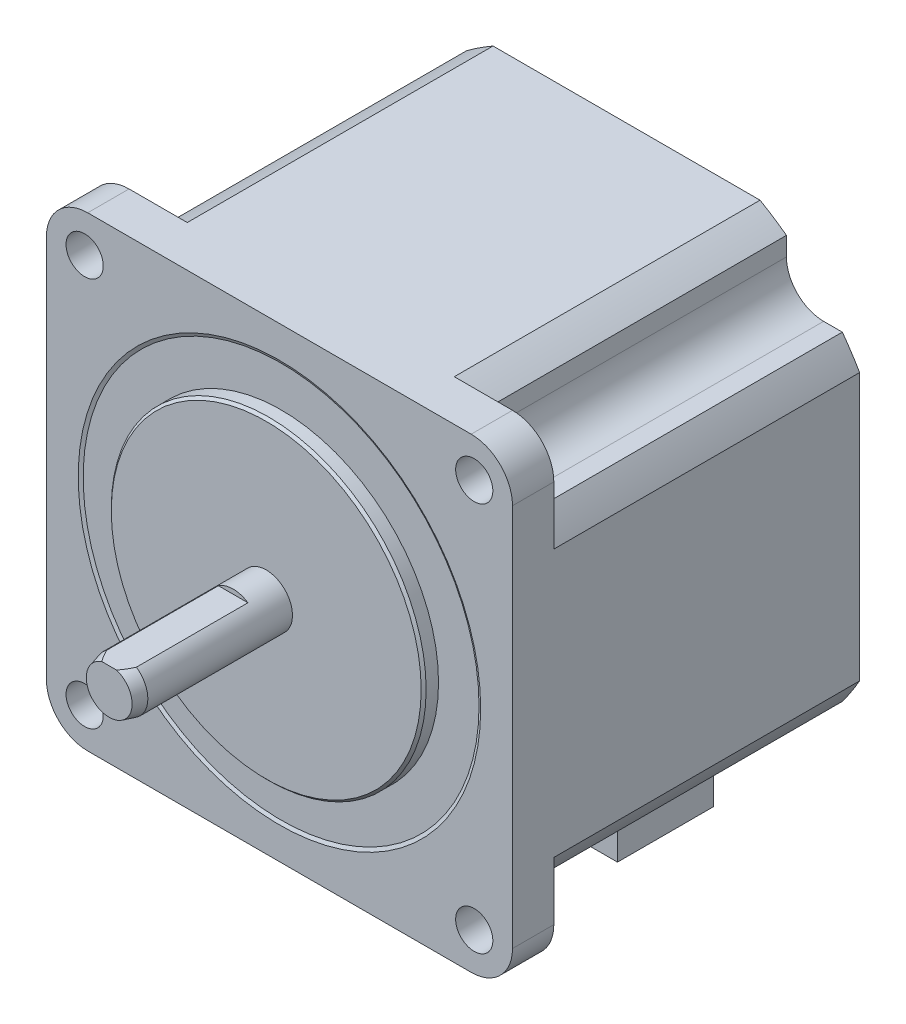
SolidWorks part; units mm, degrees
ref_plane "正面" through (0, 0, 0) normal (0, 0, 1) x (1, 0, 0)
ref_plane "平面" through (0, 0, 0) normal (0, 1, 0) x (1, 0, 0)
ref_plane "右側面" through (0, 0, 0) normal (1, 0, 0) x (0, 0, -1)
sketch "ｽｹｯﾁ1" plane through (0, 0, 0) normal (0, 0, 1) x (1, 0, 0)
  circle A0 centre (0, 0) radius 3.175
  dimension "D1" = 6.35
extrude "押し出し1" add sketch "ｽｹｯﾁ1" along normal blind 19
sketch "ｽｹｯﾁ2" plane through (0, 0, 0) normal (0, 0, -1) x (-1, 0, 0)
  circle A0 centre (0, 0) radius 19.05
  dimension "D1" = 38.1
extrude "押し出し2" add sketch "ｽｹｯﾁ2" along normal blind 1.6
sketch "ｽｹｯﾁ3" plane through (0, 0, -1.6) normal (0, 0, -1) x (-1, 0, 0)
  line L1 (-28.2, 28.2) -> (28.2, 28.2)
  line L2 (-28.2, 28.2) -> (-28.2, -28.2)
  line L3 (-28.2, -28.2) -> (28.2, -28.2)
  line L4 (28.2, 28.2) -> (28.2, -28.2)
  line L5 (-28.2, 28.2) -> (28.2, -28.2) construction
  line L6 (-28.2, -28.2) -> (28.2, 28.2) construction
  line L7 (23.57, 23.57) -> (-23.57, 23.57) construction
  line L8 (23.57, 23.57) -> (23.57, -23.57) construction
  line L9 (23.57, -23.57) -> (-23.57, -23.57) construction
  line L10 (-23.57, 23.57) -> (-23.57, -23.57) construction
  line L11 (23.57, 23.57) -> (-23.57, -23.57) construction
  line L12 (23.57, -23.57) -> (-23.57, 23.57) construction
  circle A0 centre (23.57, 23.57) radius 2.25
  circle A1 centre (-23.57, 23.57) radius 2.25
  circle A2 centre (23.57, -23.57) radius 2.25
  circle A3 centre (-23.57, -23.57) radius 2.25
  point P0 (0, 0)
  point P6 (0, 0)
  dimension "D3" = 47.14
  dimension "D4" = 47.14
  dimension "D6" = 4.5
  dimension "D1" = 56.4
  dimension "D2" = 56.4
extrude "押し出し3" add sketch "ｽｹｯﾁ3" along normal blind 5
fillet "Fillet1" radius 5 4 edges at (28.2, -28.2, -4.1) (-28.2, -28.2, -4.1) (-28.2, 28.2, -4.1) (28.2, 28.2, -4.1)
sketch "ｽｹｯﾁ4" plane through (0, 0, -6.6) normal (0, 0, -1) x (-1, 0, 0)
  line L0 (19.35, 19.35) -> (28.2, 19.35)
  line L1 (-19.35, 28.2) -> (19.35, 28.2)
  line L2 (-19.35, 28.2) -> (-19.35, 19.35)
  line L3 (-19.35, -28.2) -> (19.35, -28.2)
  line L4 (19.35, 28.2) -> (19.35, 19.35)
  line L5 (-19.35, 28.2) -> (19.35, -28.2) construction
  line L6 (-19.35, -28.2) -> (19.35, 28.2) construction
  line L7 (-28.2, 19.35) -> (-19.35, 19.35)
  line L8 (-28.2, 19.35) -> (-28.2, -19.35)
  line L9 (-28.2, -19.35) -> (-19.35, -19.35)
  line L10 (28.2, 19.35) -> (28.2, -19.35)
  line L11 (-28.2, 19.35) -> (28.2, -19.35) construction
  line L12 (-28.2, -19.35) -> (28.2, 19.35) construction
  line L13 (-19.35, -19.35) -> (-19.35, -28.2)
  line L14 (19.35, -19.35) -> (28.2, -19.35)
  line L15 (19.35, -19.35) -> (19.35, -28.2)
  circle A0 centre (0, 0) radius 32.5
  point P0 (0, 0)
  point P6 (0, 0)
  dimension "D5" = 65
  dimension "D1" = 38.7
  dimension "D2" = 56.4
  dimension "D3" = 56.4
  dimension "D4" = 38.7
extrude "押し出し4" add sketch "ｽｹｯﾁ4" along normal blind 37 contours L10 A0 L0 L4 L1 L2 L7 L8 L9 L13 L3 L15 L14
fillet "Fillet2" radius 4.5 4 edges at (19.35, -19.35, -25.1) (-19.35, -19.35, -25.1) (-19.35, 19.35, -25.1) (19.35, 19.35, -25.1)
sketch "Sketch1" plane through (0, -28.2, 0) normal (0, -1, 0) x (1, 0, 0)
  line L0 (16.1558, -43.6) -> (-16.1558, -43.6) construction
  line L1 (-10.5, -43.6) -> (10.5, -43.6)
  line L2 (-10.5, -43.6) -> (-10.5, -32)
  line L3 (-10.5, -32) -> (10.5, -32)
  line L4 (10.5, -43.6) -> (10.5, -32)
  dimension "D1" = 11.6
  dimension "D2" = 21
  dimension "D3" = 10.5
extrude "Extrude1" add sketch "Sketch1" along normal blind 10
chamfer "Chamfer5" distance 1.5 angle 15 1 edges at (3.175, 0, 19)
sketch "Sketch2" plane through (0, 0, 19) normal (0, 0, 1) x (1, 0, 0)
  line L1 (-4.7278, 5.1185) -> (3.4221, 5.1185)
  line L2 (-4.7278, 5.1185) -> (-4.7278, 2.625)
  line L3 (-4.7278, 2.625) -> (3.4221, 2.625)
  line L4 (3.4221, 5.1185) -> (3.4221, 2.625)
  dimension "D1" = 2.625
extrude "Extrude2" cut sketch "Sketch2" against normal blind 15
sketch "Sketch6" plane through (0, 0, -1.6) normal (0, 0, 1) x (1, 0, 0)
  circle A0 centre (0, 0) radius 19.05
  circle A1 centre (0, 0) radius 24.35
  dimension "D1" = 48.7
  dimension "D2" = 38.1
extrude "Extrude6" cut sketch "Sketch6" against normal blind 0.2
chamfer "Chamfer6" distance 0.2 distance2 0.4 1 edges at (24.35, 0, -1.8)
chamfer "Chamfer2" distance 0.3 angle 45 1 edges at (-19.05, 0, 0)
